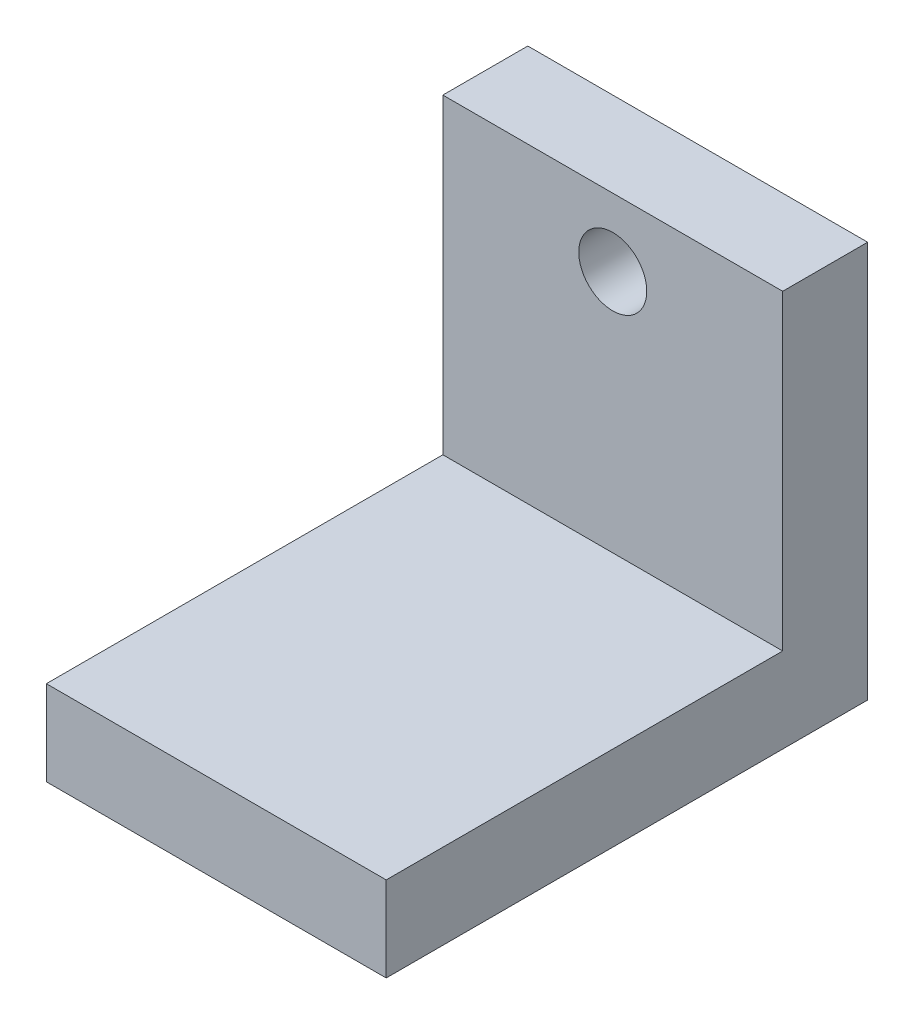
SolidWorks part; units mm, degrees
ref_plane "Front Plane" through (0, 0, 0) normal (0, 0, 1) x (1, 0, 0)
ref_plane "Top Plane" through (0, 0, 0) normal (0, 1, 0) x (1, 0, 0)
ref_plane "Right Plane" through (0, 0, 0) normal (1, 0, 0) x (0, 0, -1)
sketch "Sketch2" plane through (0, 0, 0) normal (1, 0, 0) x (0, 0, -1)
  line L1 (-17.5, 3.75) -> (17.5, 3.75)
  line L2 (-17.5, 3.75) -> (-17.5, -3.75)
  line L3 (-17.5, -3.75) -> (17.5, -3.75)
  line L7 (17.5, -3.75) -> (25, -3.75)
  line L8 (17.5, 3.75) -> (17.5, 31.25)
  line L9 (17.5, 31.25) -> (25, 31.25)
  line L10 (25, -3.75) -> (25, 31.25)
  point P0 (0, 0)
  dimension "D1" = 35
  dimension "D2" = 7.5
  dimension "D3" = 35
  dimension "D4" = 7.5
extrude "Boss-Extrude1" add sketch "Sketch2" along normal blind 30
sketch "Sketch3" plane through (0, 0, -17.5) normal (0, 0, 1) x (1, 0, 0)
  line L0 (30, 31.25) -> (0, 31.25) construction
  circle A0 centre (15, 25.25) radius 3
  point P4 (15, 31.25)
  dimension "D1" = 6
  dimension "D2" = 6
extrude "Cut-Extrude1" cut sketch "Sketch3" against normal through all both and the other way through all contours A0
